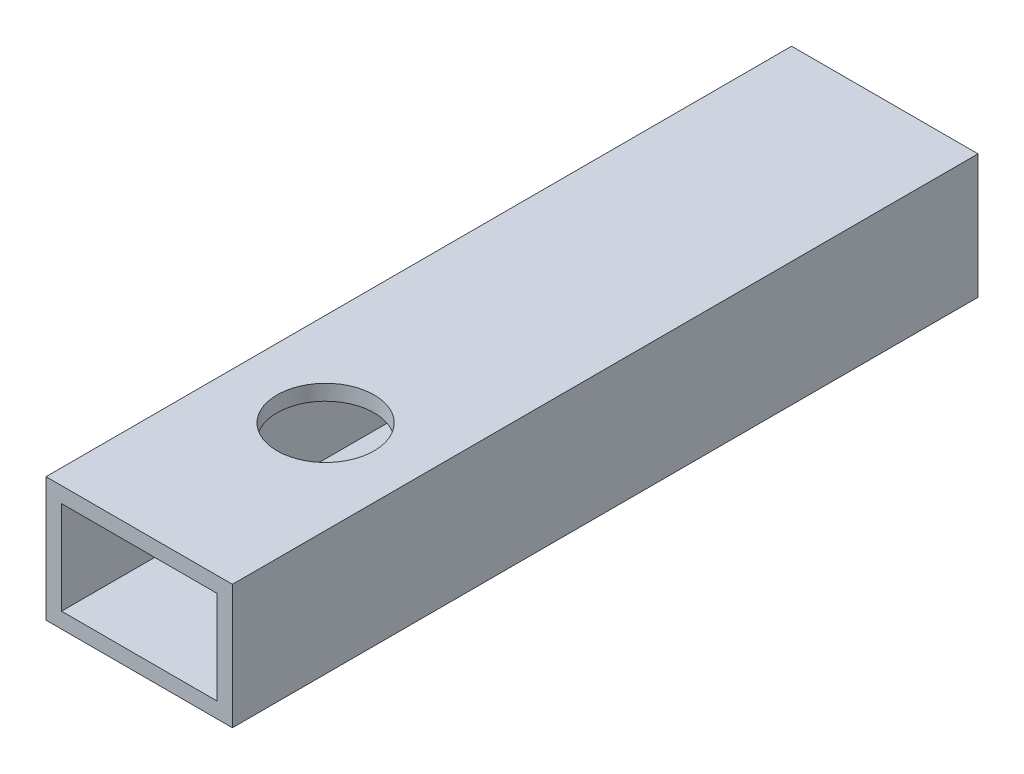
SolidWorks part; units mm, degrees
ref_plane "Front Plane" through (0, 0, 0) normal (0, 0, 1) x (1, 0, 0)
ref_plane "Top Plane" through (0, 0, 0) normal (0, 1, 0) x (1, 0, 0)
ref_plane "Right Plane" through (0, 0, 0) normal (1, 0, 0) x (0, 0, -1)
sketch "Sketch1" plane through (0, 0, 0) normal (0, 0, 1) x (1, 0, 0)
  line L0 (-31.75, -19.05) -> (-31.75, 19.05)
  line L1 (-38.1, -25.4) -> (38.1, -25.4)
  line L2 (-38.1, -25.4) -> (-38.1, 25.4)
  line L3 (-38.1, 25.4) -> (38.1, 25.4)
  line L4 (38.1, -25.4) -> (38.1, 25.4)
  line L5 (-31.75, 19.05) -> (31.75, 19.05)
  line L6 (31.75, -19.05) -> (31.75, 19.05)
  line L7 (-31.75, -19.05) -> (31.75, -19.05)
  dimension "D1" = 38.1
  dimension "D2" = 76.2
  dimension "D3" = 25.4
  dimension "D4" = 50.8
  dimension "D5" = 6.35
extrude "Extrude1" add sketch "Sketch1" against normal blind 304.8
sketch "Sketch2" plane through (0, 25.4, 0) normal (0, 1, 0) x (-1, 0, 0)
  circle A0 centre (0, -76.2) radius 19.8374
  dimension "D1" = 39.6748
  dimension "D2" = 76.2
extrude "Cut-Extrude1" cut sketch "Sketch2" against normal blind 12.7
